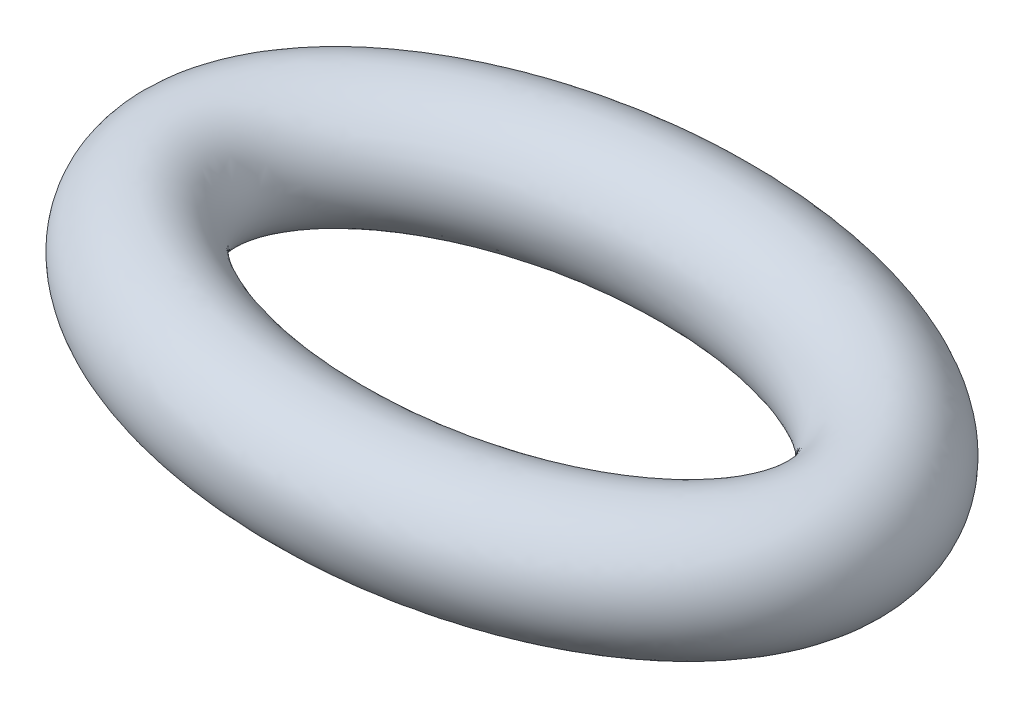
SolidWorks part; units mm, degrees
ref_plane "Front Plane" through (0, 0, 0) normal (0, 0, 1) x (1, 0, 0)
ref_plane "Top Plane" through (0, 0, 0) normal (0, 1, 0) x (1, 0, 0)
ref_plane "Right Plane" through (0, 0, 0) normal (1, 0, 0) x (0, 0, -1)
sketch "Sketch1" plane through (0, 0, 0) normal (0, 1, 0) x (1, 0, 0)
  ellipse E0 centre (0, 0) end of major axis (15.875, 0) minor radius 9.525
  dimension "D1" = 31.75
  dimension "D2" = 19.05
sketch "Sketch2" plane through (0, 0, 0) normal (0, 0, 1) x (1, 0, 0)
  circle A0 centre (15.875, 0) radius 3.175
  dimension "D1" = 6.35
sweep "Sweep1" add profiles "Sketch2" path "Sketch1"
